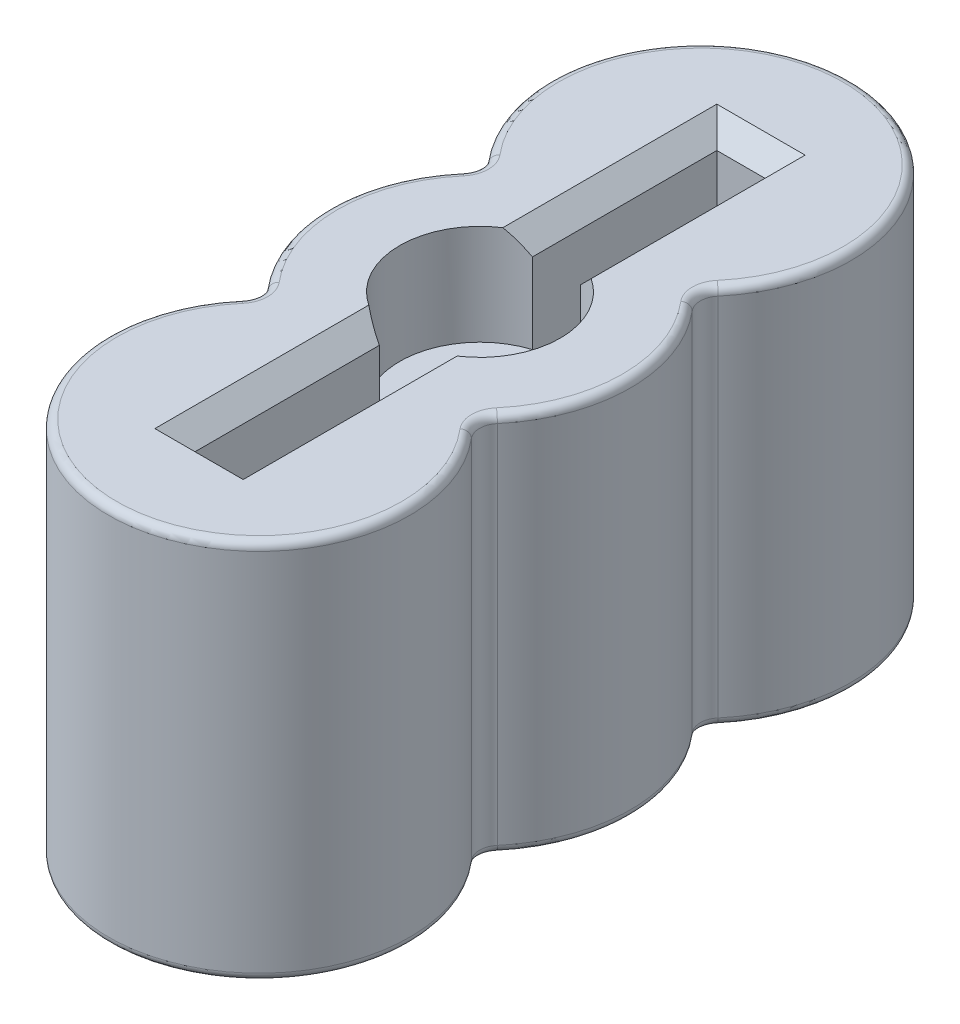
SolidWorks part; units mm, degrees
ref_plane "Front Plane" through (0, 0, 0) normal (0, 0, 1) x (1, 0, 0)
ref_plane "Top Plane" through (0, 0, 0) normal (0, 1, 0) x (1, 0, 0)
ref_plane "Right Plane" through (0, 0, 0) normal (1, 0, 0) x (0, 0, -1)
ref_plane "Plane1" through (0, -4.75, 0) normal (0, -1, 0) x (1, 0, 0)
sketch "Sketch1" plane through (0, -4.75, 0) normal (0, -1, 0) x (1, 0, 0)
  arc A0 (-2.5495, 2.75) -> (2.5495, 2.75) centre (0, 0) ccw
  arc A1 (2.5495, 2.75) -> (-2.5495, 2.75) centre (0, 5.5) ccw
extrude "Boss-Extrude1" add sketch "Sketch1" against normal blind 9.5
ref_plane "Plane2" through (0, 4.75, 0) normal (0, 1, 0) x (1, 0, 0)
sketch "Sketch2" plane through (0, 4.75, 0) normal (0, 1, 0) x (1, 0, 0)
  arc A0 (2.5495, 2.75) -> (-2.5495, 2.75) centre (0, 5.5) ccw
  arc A1 (-2.5495, 2.75) -> (2.5495, 2.75) centre (0, 0) cw
extrude "Boss-Extrude2" add sketch "Sketch2" against normal blind 9.5
sketch "Sketch3" plane through (0, 4.75, 0) normal (0, 1, 0) x (-1, 0, 0)
  line L0 (-0.6, -6.5) -> (0.6, -6.5)
  line L1 (0.6, -6.5) -> (0.6, 6.5)
  line L2 (0.6, 6.5) -> (-0.6, 6.5)
  line L3 (-0.6, 6.5) -> (-0.6, -6.5)
extrude "Cut-Extrude1" cut sketch "Sketch3" against normal through all
sketch "Sketch4" plane through (0, -4.75, 0) normal (0, -1, 0) x (1, 0, 0)
  line L0 (-0.6, -1.9079) -> (-0.6, 1.9079)
  arc A0 (-0.6, 1.9079) -> (-0.6, -1.9079) centre (0, 0) ccw
extrude "Cut-Extrude2" cut sketch "Sketch4" against normal blind 2.5
sketch "Sketch5" plane through (0, 4.75, 0) normal (0, 1, 0) x (-1, 0, 0)
  line L0 (0.6, 1.9079) -> (0.6, -1.9079)
  arc A0 (0.6, -1.9079) -> (0.6, 1.9079) centre (0, 0) ccw
extrude "Cut-Extrude3" cut sketch "Sketch5" against normal blind 2.5
sketch "Sketch6" plane through (0, -4.75, 0) normal (0, -1, 0) x (1, 0, 0)
  line L0 (0.6, 1.9079) -> (0.6, -1.9079)
  arc A0 (0.6, -1.9079) -> (0.6, 1.9079) centre (0, 0) ccw
extrude "Cut-Extrude4" cut sketch "Sketch6" against normal blind 2.5
sketch "Sketch7" plane through (0, 4.75, 0) normal (0, 1, 0) x (-1, 0, 0)
  line L0 (-0.6, -1.9079) -> (-0.6, 1.9079)
  arc A0 (-0.6, 1.9079) -> (-0.6, -1.9079) centre (0, 0) ccw
extrude "Cut-Extrude5" cut sketch "Sketch7" against normal blind 2.5
fillet "Fillet1" radius 0.5 4 edges at (2.5495, 0, 2.75) (-2.5495, 0, 2.75) (2.5495, 0, -2.75) (-2.5495, 0, -2.75)
chamfer "Chamfer1" distance 0.5 angle 45 12 edges at (0.6, -4.75, -4.2039) (0, -4.75, -6.5) (-0.6, -4.75, -4.2039) (0.6, 4.75, -4.2039) (0, 4.75, -6.5) (-0.6, 4.75, -4.2039) (-0.6, 4.75, 4.2039) (0.6, 4.75, 4.2039) (0, 4.75, 6.5) (-0.6, -4.75, 4.2039) (0, -4.75, 6.5) (0.6, -4.75, 4.2039)
fillet "Fillet2" radius 0.2 16 edges at (0, 4.75, 9.25) (-2.7404, 4.75, 2.75) (2.7404, 4.75, 2.75) (-3.75, 4.75, 0) (3.75, 4.75, 0) (-2.7404, 4.75, -2.75) (2.7404, 4.75, -2.75) (0, 4.75, -9.25) (0, -4.75, -9.25) (-2.7404, -4.75, -2.75) (-3.75, -4.75, 0) (2.7404, -4.75, -2.75) (-2.7404, -4.75, 2.75) (3.75, -4.75, 0) (0, -4.75, 9.25) (2.7404, -4.75, 2.75)
